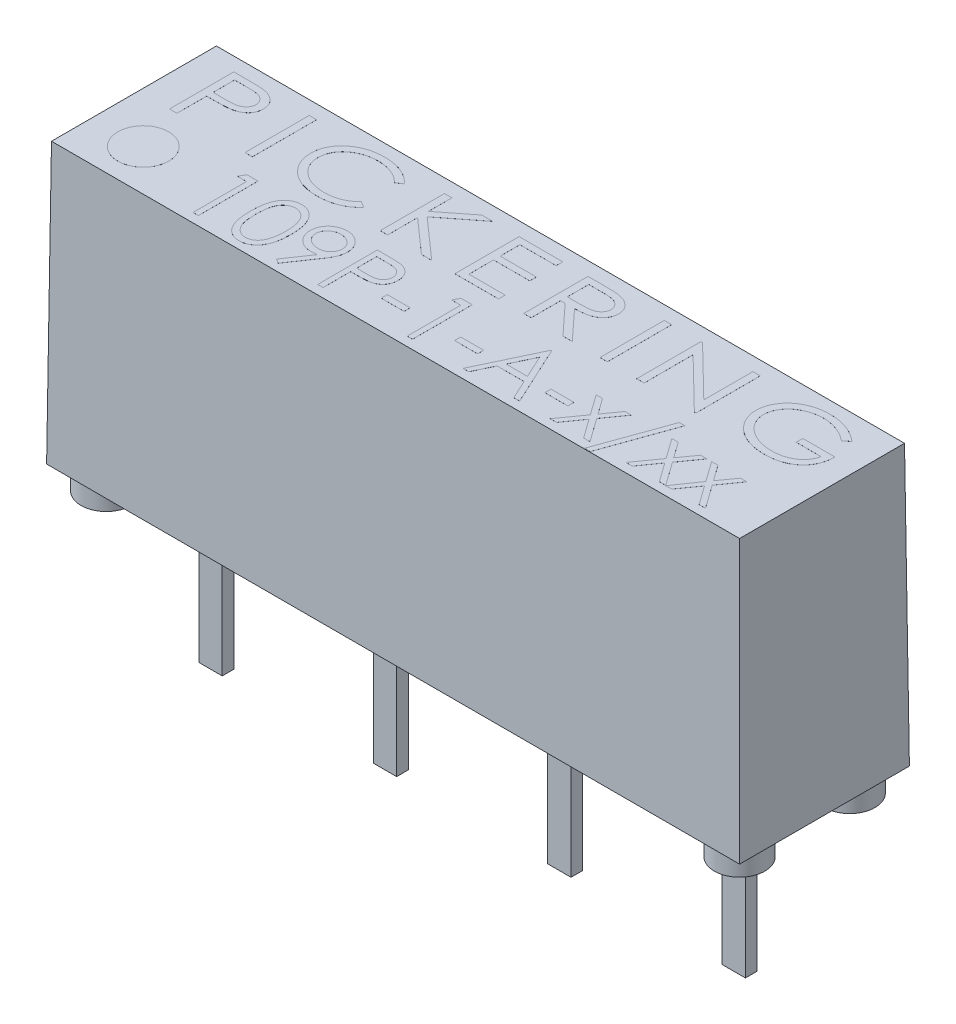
SolidWorks part; units mm, degrees
ref_plane "Front Plane" through (0, 0, 0) normal (0, 0, 1) x (1, 0, 0)
ref_plane "Top Plane" through (0, 0, 0) normal (0, 1, 0) x (1, 0, 0)
ref_plane "Right Plane" through (0, 0, 0) normal (1, 0, 0) x (0, 0, -1)
sketch "Sketch1" plane through (0, 0, 0) normal (0, 1, 0) x (1, 0, 0)
  line L1 (7.55, -1.85) -> (-7.55, -1.85)
  line L2 (7.55, -1.85) -> (7.55, 1.85)
  line L3 (7.55, 1.85) -> (-7.55, 1.85)
  line L4 (-7.55, -1.85) -> (-7.55, 1.85)
  line L5 (7.55, -1.85) -> (-7.55, 1.85) construction
  line L6 (7.55, 1.85) -> (-7.55, -1.85) construction
  point P0 (0, 0)
  dimension "D1" = 3.7
  dimension "D2" = 15.1
extrude "Main body" add sketch "Sketch1" along normal blind 6.092 draft 0.5
sketch "Sketch2" plane through (0, 0, 0) normal (0, -1, 0) x (1, 0, 0)
  line L1 (-5.446, -0.127) -> (-5.954, -0.127)
  line L2 (-5.446, -0.127) -> (-5.446, 0.127)
  line L3 (-5.446, 0.127) -> (-5.954, 0.127)
  line L4 (-5.954, -0.127) -> (-5.954, 0.127)
  line L5 (-5.446, -0.127) -> (-5.954, 0.127) construction
  line L6 (-5.446, 0.127) -> (-5.954, -0.127) construction
  line L8 (7.55, 1.85) -> (7.55, -1.85) construction
  line L9 (-2.154, -0.127) -> (-1.646, -0.127)
  line L10 (-2.154, -0.127) -> (-2.154, 0.127)
  line L11 (-2.154, 0.127) -> (-1.646, 0.127)
  line L12 (-1.646, -0.127) -> (-1.646, 0.127)
  line L13 (-2.154, -0.127) -> (-1.646, 0.127) construction
  line L14 (-2.154, 0.127) -> (-1.646, -0.127) construction
  line L15 (2.154, -0.127) -> (1.646, -0.127)
  line L16 (2.154, -0.127) -> (2.154, 0.127)
  line L17 (2.154, 0.127) -> (1.646, 0.127)
  line L18 (1.646, -0.127) -> (1.646, 0.127)
  line L19 (2.154, -0.127) -> (1.646, 0.127) construction
  line L20 (2.154, 0.127) -> (1.646, -0.127) construction
  line L21 (5.954, -0.127) -> (5.446, -0.127)
  line L22 (5.954, -0.127) -> (5.954, 0.127)
  line L23 (5.954, 0.127) -> (5.446, 0.127)
  line L24 (5.446, -0.127) -> (5.446, 0.127)
  line L25 (5.954, -0.127) -> (5.446, 0.127) construction
  line L26 (5.954, 0.127) -> (5.446, -0.127) construction
  point P0 (-5.7, 0)
  point P5 (-1.9, 0)
  point P12 (1.9, 0)
  point P17 (5.7, 0)
  dimension "D1" = 0.254
  dimension "D2" = 0.508
  dimension "D3" = 0.254
  dimension "D4" = 0.508
  dimension "D5" = 0.254
  dimension "D6" = 0.254
  dimension "D7" = 0.508
  dimension "D8" = 0.508
  dimension "D9" = 3.8
  dimension "D10" = 3.8
  dimension "D11" = 3.8
  dimension "D12" = 1.85
extrude "Pins" add sketch "Sketch2" along normal blind 3.808
sketch "Sketch3"
  dimension "D1" = 1.7
  dimension "D2" = 1.1
  dimension "D3" = 0.9
extrude "Writting" add sketch "Sketch3" along normal blind 0.001
sketch "Sketch5" plane through (0, 0, 0) normal (0, -1, 0) x (1, 0, 0)
  line L0 (-7.55, 1.85) -> (7.55, 1.85) construction
  line L1 (-7.55, -1.85) -> (-7.55, 1.85) construction
  circle A0 centre (-6.9, 1.2) radius 0.55
  dimension "D1" = 1.1
  dimension "D2" = 0.65
  dimension "D3" = 0.65
extrude "Extrude4" add sketch "Sketch5" along normal blind 0.508
mirror "foot" about plane through (0, 0, 0) normal (0, 0, 1) of "Extrude4"
mirror "feet" about plane through (0, 0, 0) normal (1, 0, 0) of "foot", "Extrude4"
